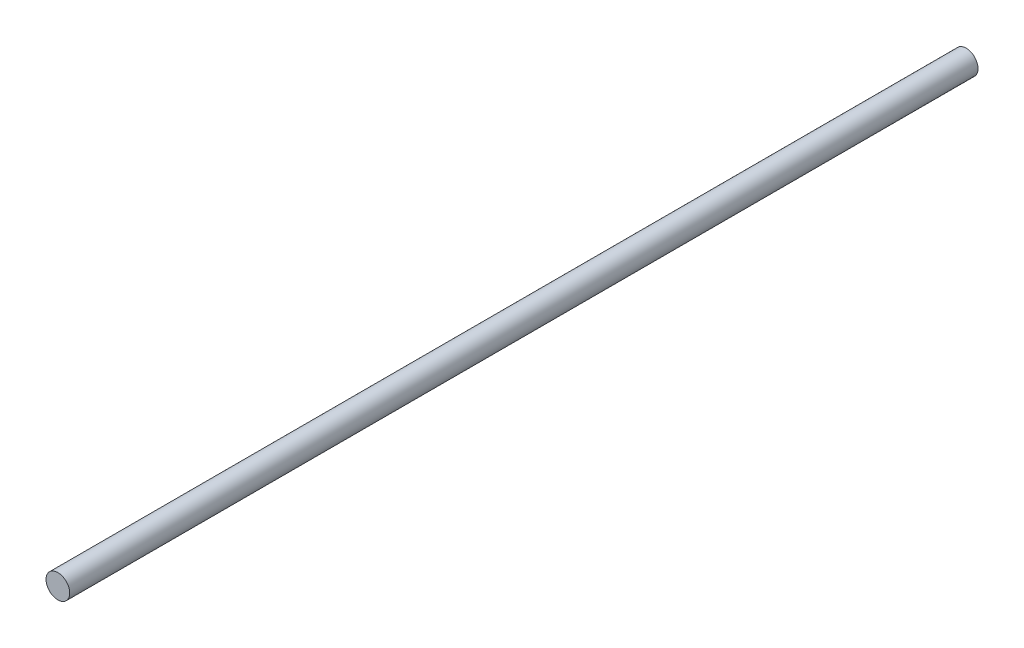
SolidWorks part; units mm, degrees
ref_plane "Plane1" through (0, 0, 0) normal (0, 0, 1) x (1, 0, 0)
ref_plane "Plane2" through (0, 0, 0) normal (0, 1, 0) x (1, 0, 0)
ref_plane "Plane3" through (0, 0, 0) normal (1, 0, 0) x (0, 0, -1)
sketch "Sketch1" plane through (0, 0, 0) normal (0, 0, 1) x (1, 0, 0)
  circle A0 centre (0, 0) radius 0.762
  dimension "D1" = 1.524
extrude "Base-Extrude" add sketch "Sketch1" along normal blind 58.42
